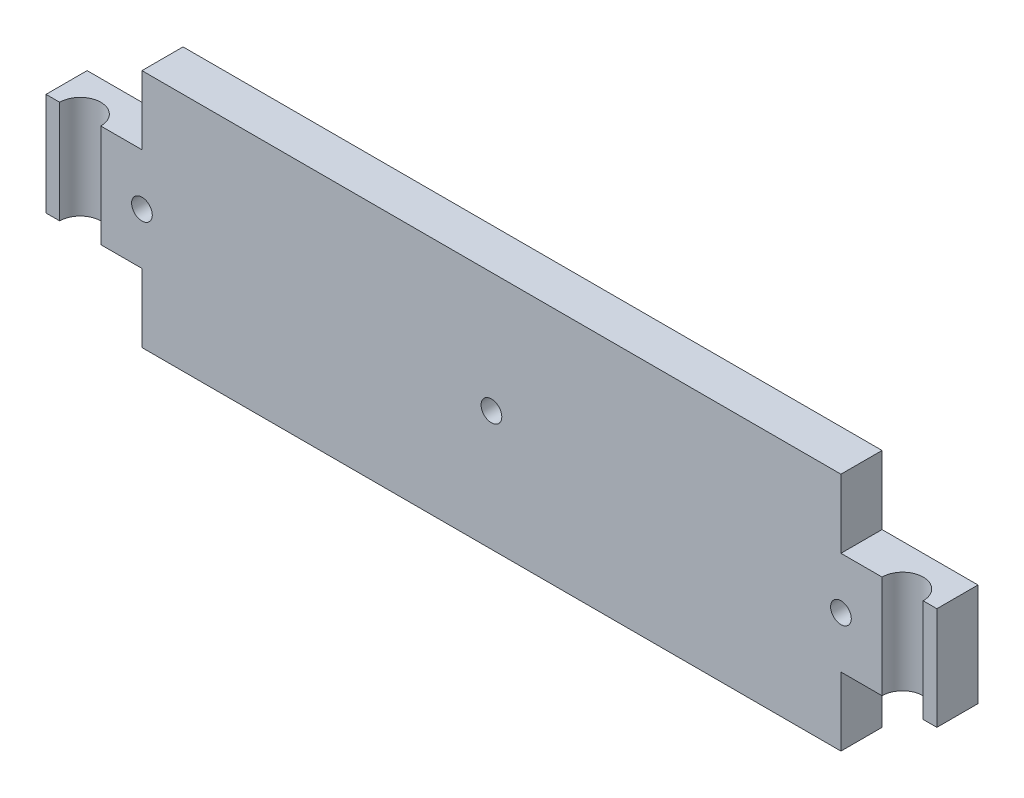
SolidWorks part; units mm, degrees
ref_plane "Plan de face" through (0, 0, 0) normal (0, 0, 1) x (1, 0, 0)
ref_plane "Plan de dessus" through (0, 0, 0) normal (0, 1, 0) x (1, 0, 0)
ref_plane "Plan de droite" through (0, 0, 0) normal (1, 0, 0) x (0, 0, -1)
sketch "Esquisse1" plane through (0, 0, 0) normal (0, 0, 1) x (1, 0, 0)
  line L0 (9, 126.1328) -> (9, -9.4638) construction
  line L1 (0, 0) -> (120, 0) construction
  line L2 (0, 0) -> (0, 120) construction
  line L3 (-10.0831, 17.5) -> (128.7003, 17.5) construction
  line L4 (120, 0) -> (120, 120) construction
  line L5 (-5, 120) -> (-5, 0) construction
  line L6 (60, -9.4638) -> (60, 126.1328) construction
  line L7 (125, 120) -> (125, 0) construction
  line L8 (-8.1162, 10) -> (127.8789, 10) construction
  line L9 (-5, 25) -> (-5, 10)
  line L10 (111, 126.1328) -> (111, -9.4638) construction
  line L11 (153.523, 35) -> (-16.256, 35) construction
  line L12 (-5, 10) -> (9, 10)
  line L13 (9, 10) -> (9, 0)
  line L14 (9, 0) -> (111, 0)
  line L15 (127.1523, 25) -> (-8.1162, 25) construction
  line L16 (111, 0) -> (111, 10)
  line L17 (111, 10) -> (125, 10)
  line L18 (125, 10) -> (125, 25)
  line L19 (125, 25) -> (111, 25)
  line L20 (111, 25) -> (111, 35)
  line L21 (111, 35) -> (9, 35)
  line L22 (9, 35) -> (9, 25)
  line L23 (9, 25) -> (-5, 25)
  circle A0 centre (9, 17.5) radius 1.51
  circle A1 centre (60, 17.5) radius 1.51
  circle A2 centre (111, 17.5) radius 1.51
  dimension "D1" = 7.5
  dimension "D2" = 7.5
extrude "Extrusion1" add sketch "Esquisse1" along normal blind 6
sketch "Esquisse2" plane through (0, 35, 0) normal (0, 1, 0) x (-1, 0, 0)
  line L0 (10.0538, 6) -> (-130.3009, 6) construction
  line L1 (0, -5) -> (0, 20.9743) construction
  line L3 (-120, 20.9743) -> (-120, -5.1833) construction
  circle A0 centre (0, 6) radius 3
  circle A1 centre (-120, 6) radius 3
extrude "Enlèv. mat.-Extru.1" cut sketch "Esquisse2" against normal through all
